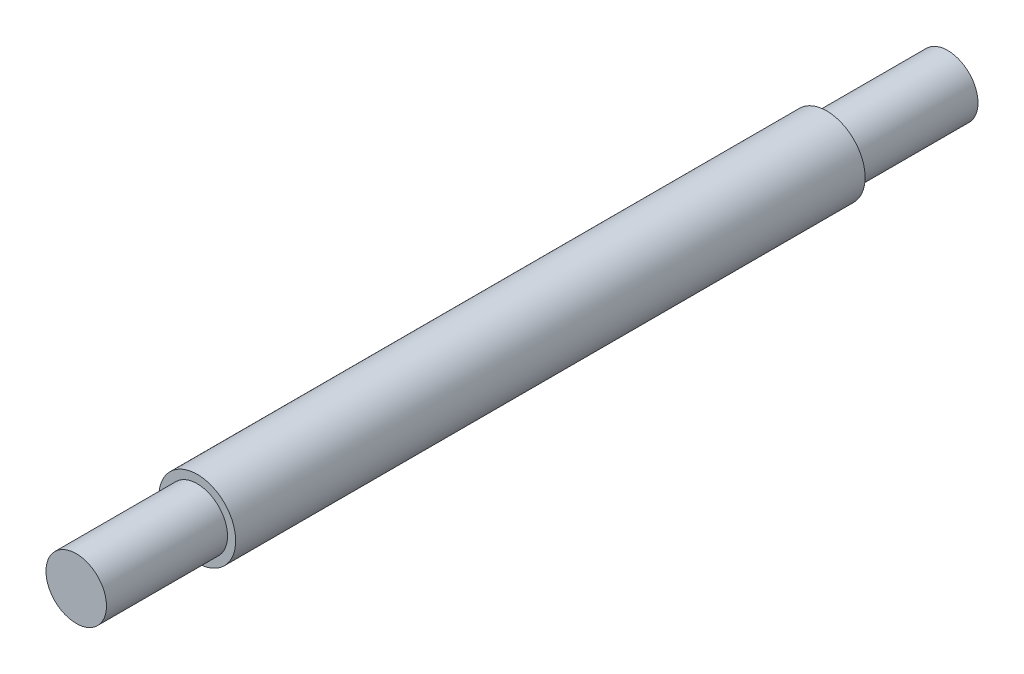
SolidWorks part; units mm, degrees
ref_plane "Plano frontal" through (0, 0, 0) normal (0, 0, 1) x (1, 0, 0)
ref_plane "Plano superior" through (0, 0, 0) normal (0, 1, 0) x (1, 0, 0)
ref_plane "Plano direito" through (0, 0, 0) normal (1, 0, 0) x (0, 0, -1)
sketch "Esboço1" plane through (0, 0, 0) normal (0, 0, 1) x (1, 0, 0)
  circle A0 centre (0, 0) radius 2.5
  dimension "D1" = 5
extrude "Ressalto-extrusão1" add sketch "Esboço1" along normal blind 10
sketch "Esboço2" plane through (0, 0, 10) normal (0, 0, 1) x (1, 0, 0)
  circle A0 centre (0, 0) radius 3.175
  dimension "D1" = 6.35
extrude "Ressalto-extrusão2" add sketch "Esboço2" along normal blind 52
sketch "Esboço3" plane through (0, 0, 62) normal (0, 0, 1) x (1, 0, 0)
  circle A0 centre (0, 0) radius 2.5
  dimension "D1" = 5
extrude "Ressalto-extrusão3" add sketch "Esboço3" along normal blind 10
